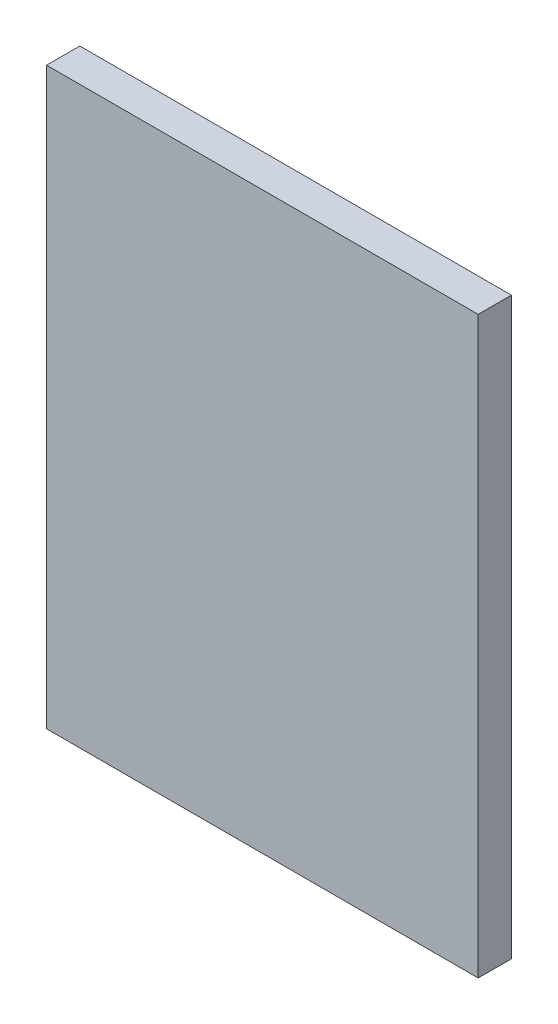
SolidWorks part; units mm, degrees
ref_plane "Спереди" through (0, 0, 0) normal (0, 0, 1) x (1, 0, 0)
ref_plane "Сверху" through (0, 0, 0) normal (0, 1, 0) x (1, 0, 0)
ref_plane "Справа" through (0, 0, 0) normal (1, 0, 0) x (0, 0, -1)
sketch "Эскиз1" plane through (0, 0, 0) normal (0, 0, 1) x (1, 0, 0)
  line L1 (0, 0) -> (208, 0)
  line L2 (0, 0) -> (0, -277)
  line L3 (0, -277) -> (208, -277)
  line L4 (208, 0) -> (208, -277)
  dimension "D1" = 208
  dimension "D2" = 277
extrude "Вытянуть1" add sketch "Эскиз1" along normal blind 16
